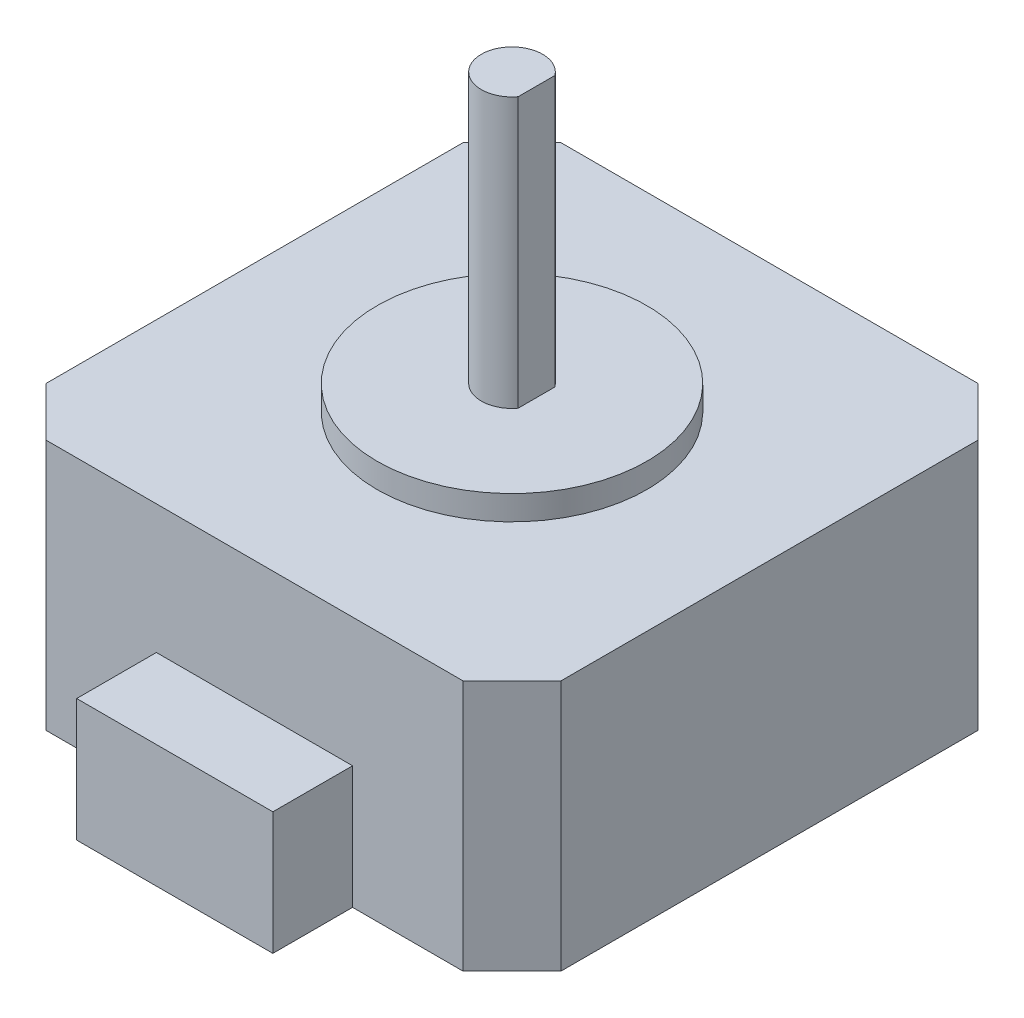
SolidWorks part; units mm, degrees
ref_plane "Front Plane" through (0, 0, 0) normal (0, 0, 1) x (1, 0, 0)
ref_plane "Top Plane" through (0, 0, 0) normal (0, 1, 0) x (1, 0, 0)
ref_plane "Right Plane" through (0, 0, 0) normal (1, 0, 0) x (0, 0, -1)
sketch "Sketch1" plane through (0, 0, 0) normal (0, 1, 0) x (1, 0, 0)
  line L0 (-17, 21) -> (-21, 17)
  line L1 (17, -21) -> (-17, -21)
  line L2 (21, -17) -> (21, 17)
  line L3 (17, 21) -> (-17, 21)
  line L4 (-21, -17) -> (-21, 17)
  line L5 (21, -21) -> (-21, 21) construction
  line L6 (21, 21) -> (-21, -21) construction
  line L7 (21, 17) -> (17, 21)
  line L8 (-17, -21) -> (-21, -17)
  line L9 (21, -17) -> (17, -21)
  point P0 (0, 0)
  dimension "D1" = 42
  dimension "D2" = 42
extrude "Boss-Extrude1" add sketch "Sketch1" along normal blind 20.5
sketch "Sketch2" plane through (0, 20.5, 0) normal (0, 1, 0) x (1, 0, 0)
  circle A0 centre (0, 0) radius 11
  dimension "D1" = 22
extrude "Boss-Extrude2" add sketch "Sketch2" along normal blind 2
sketch "Sketch3" plane through (0, 22.5, 0) normal (0, 1, 0) x (1, 0, 0)
  line L0 (2, 1.5) -> (2, -1.5)
  arc A0 (2, 1.5) -> (2, -1.5) centre (0, 0) ccw
  point P5 (-2.5, 0)
  dimension "D1" = 5
  dimension "D2" = 4.5
extrude "Boss-Extrude3" add sketch "Sketch3" along normal blind 22
sketch "Sketch4" plane through (0, 0, 0) normal (0, -1, 0) x (1, 0, 0)
  line L0 (-17, 21) -> (17, 21) construction
  line L1 (-8, 27.5) -> (8, 27.5)
  line L2 (-8, 27.5) -> (-8, 21)
  line L3 (-8, 21) -> (8, 21)
  line L4 (8, 27.5) -> (8, 21)
  line L5 (-8, 27.5) -> (8, 21) construction
  line L6 (-8, 21) -> (8, 27.5) construction
  point P0 (0, 24.25)
  dimension "D1" = 16
  dimension "D2" = 6.5
extrude "Boss-Extrude4" add sketch "Sketch4" against normal blind 10
